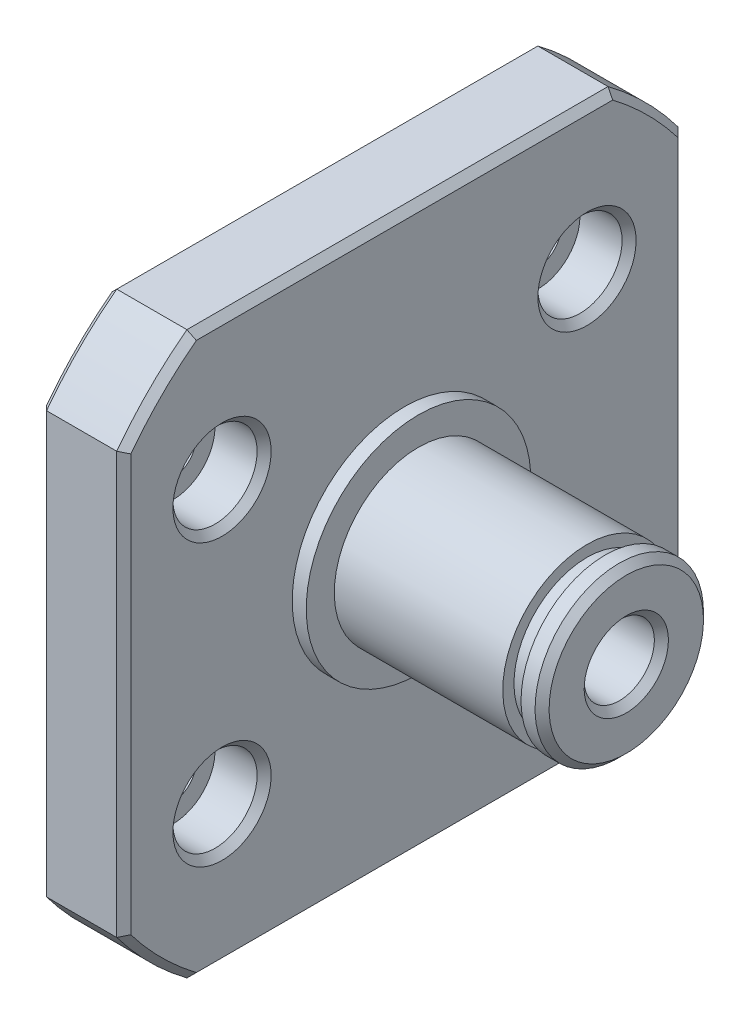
SolidWorks part; units mm, degrees
ref_plane "前视" through (0, 0, 0) normal (0, 0, 1) x (1, 0, 0)
ref_plane "上视" through (0, 0, 0) normal (0, 1, 0) x (1, 0, 0)
ref_plane "右视" through (0, 0, 0) normal (1, 0, 0) x (0, 0, -1)
sketch "草图1" plane through (0, 0, 0) normal (0, 0, 1) x (1, 0, 0)
  line L0 (0, 1.5) -> (0, 25)
  line L5 (0, 25) -> (6, 25)
  line L6 (6, 25) -> (6, 8)
  line L7 (6, 8) -> (7, 8)
  line L8 (7, 8) -> (7, 6)
  line L9 (7, 6) -> (19, 6)
  line L10 (19, 6) -> (19, 5.2)
  line L11 (19, 5.2) -> (20.3, 5.2)
  line L12 (20.3, 5.2) -> (20.3, 6)
  line L13 (20.3, 6) -> (21.8, 6)
  line L14 (21.8, 6) -> (21.8, 2.5)
  line L15 (21.8, 2.5) -> (16.8, 2.5)
  line L16 (16.8, 2.5) -> (16.8, 1.5)
  line L17 (16.8, 1.5) -> (0, 1.5)
  line L18 (15.7758, 0) -> (0, 0) construction
  dimension "D1" = 3
  dimension "D2" = 5
  dimension "D4" = 0.8
  dimension "D5" = 1.5
  dimension "D6" = 12
  dimension "D7" = 1
  dimension "D8" = 12
  dimension "D9" = 16
  dimension "D3" = 1.3
  dimension "D11" = 6
  dimension "D10" = 50
  dimension "D12" = 5
revolve "旋转1" add sketch "草图1" angle 360 about L18
sketch "草图5" plane through (6, 0, 0) normal (1, 0, 0) x (0, 0, -1)
  line L0 (0, 0) -> (0, 26.3998) construction
  line L1 (0, 0) -> (-35.521, 0) construction
  line L3 (-15, 20) -> (15, 20)
  line L4 (-20, 15) -> (-20, -15)
  line L5 (-15, -20) -> (15, -20)
  line L6 (20, 15) -> (20, -15)
  circle A0 centre (-13, 10) radius 1.65
  circle A1 centre (-13, -10) radius 1.65
  circle A2 centre (13, -10) radius 1.65
  circle A3 centre (13, 10) radius 1.65
  circle A4 centre (0, 0) radius 25 construction
  arc A5 (-20, 15) -> (-20, -15) centre (0, 0) ccw
  arc A6 (15, 20) -> (-15, 20) centre (0, 0) ccw
  arc A7 (20, -15) -> (20, 15) centre (0, 0) ccw
  arc A8 (-15, -20) -> (15, -20) centre (0, 0) ccw
  dimension "D3" = 20
  dimension "D4" = 26
  dimension "D5" = 3.3
  dimension "D1" = 40
  dimension "D2" = 40
extrude "切除-拉伸6" cut sketch "草图5" against normal through all
sketch "草图6" plane through (6, 0, 0) normal (1, 0, 0) x (0, 0, -1)
  circle A0 centre (-13, 10) radius 3
  circle A1 centre (13, 10) radius 3
  circle A2 centre (-13, -10) radius 3
  circle A3 centre (13, -10) radius 3
  dimension "D1" = 6
extrude "切除-拉伸7" cut sketch "草图6" against normal blind 3.5
chamfer "倒角2" distance 0.5 angle 45 27 edges at (0, 1.5, 0) (21.8, 6, 0) (21.8, 2.5, 0) (6, 17.6777, 17.6777) (6, 20, 0) (6, 17.6777, -17.6777) (6, 0, -20) (6, -17.6777, -17.6777) (6, -20, 0) (6, -17.6777, 17.6777) (6, 0, 20) (0, -8.35, -13) (0, -11.65, 13) (0, 11.65, 13) (0, 8.35, -13) (0, 17.6777, -17.6777) (0, 20, 0) (0, 17.6777, 17.6777) (0, 0, 20) (0, -17.6777, 17.6777) (0, -20, 0) (0, -17.6777, -17.6777) (0, 0, -20) (6, -7, -13) (6, -7, 13) (6, 13, -13) (6, 13, 13)
sketch "草图7" plane through (21.8, 0, 0) normal (1, 0, 0) x (0, 0, -1)
  line L0 (-10.9669, 0) -> (12.0581, 0) construction
  line L1 (-6.0597, 0) -> (6.0597, 0) construction
  line L2 (-2, 1.5) -> (2, 1.5)
  line L3 (-2, -1.5) -> (2, -1.5)
  circle A6 centre (0, 0) radius 2.5 construction
  arc A7 (2, -1.5) -> (2, 1.5) centre (0, 0) ccw
  arc A8 (-2, 1.5) -> (-2, -1.5) centre (0, 0) ccw
  point P6 (0, 0)
  dimension "D1" = 3
extrude "切除-拉伸8" cut sketch "草图7" against normal through all
